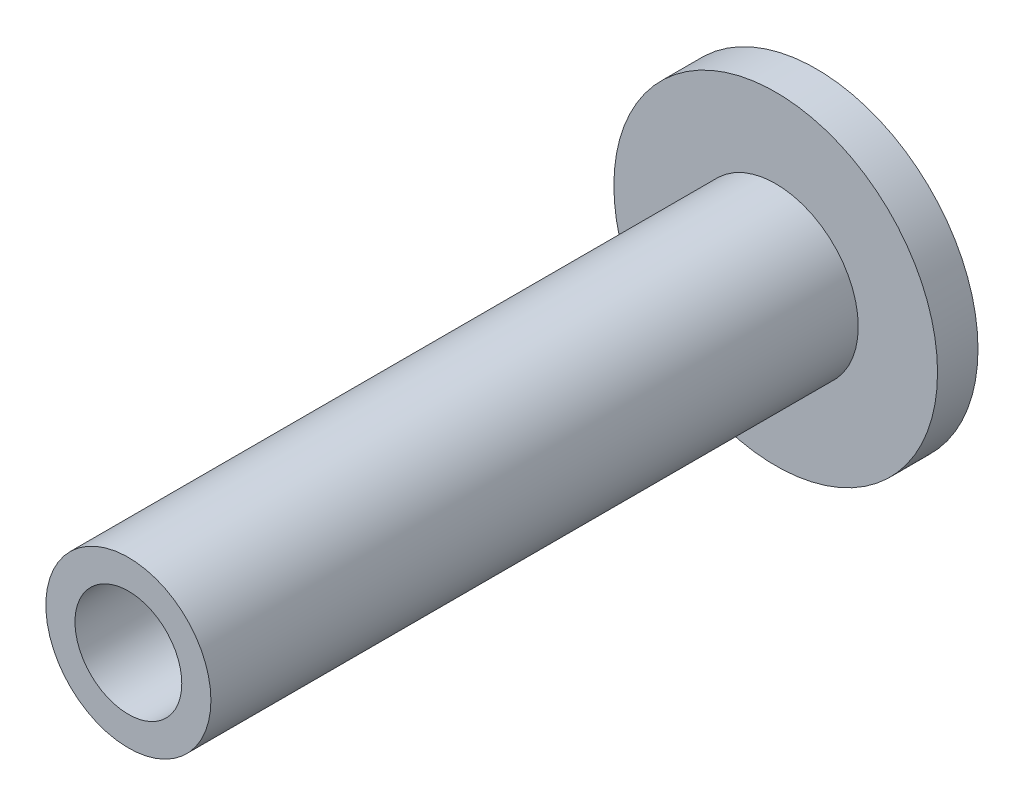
SolidWorks part; units mm, degrees
ref_plane "Front Plane" through (0, 0, 0) normal (0, 0, 1) x (1, 0, 0)
ref_plane "Top Plane" through (0, 0, 0) normal (0, 1, 0) x (1, 0, 0)
ref_plane "Right Plane" through (0, 0, 0) normal (1, 0, 0) x (0, 0, -1)
sketch "Sketch1" plane through (0, 0, 0) normal (0, 0, 1) x (1, 0, 0)
  circle A0 centre (-38.1, -101.6) radius 6.35 construction
  circle A1 centre (-38.1, -101.6) radius 6.35
  circle A2 centre (-38.1, -101.6) radius 3.2385 construction
  dimension "D1" = 6.477
extrude "Extrude1" add sketch "Sketch1" against normal up to surface (1.5875 mm away)
sketch "Sketch2" plane through (0, 0, 0) normal (0, 0, 1) x (1, 0, 0)
  circle A0 centre (-38.1, -101.6) radius 3.2385 construction
  circle A1 centre (-38.1, -101.6) radius 3.2385
extrude "Extrude2" add sketch "Sketch2" along normal blind 25.4
sketch "Sketch3" plane through (0, 0, 25.4) normal (0, 0, 1) x (1, 0, 0)
  circle A0 centre (-38.1, -101.6) radius 2.0955
  dimension "D1" = 4.191
extrude "Cut-Extrude1" cut sketch "Sketch3" against normal through all
